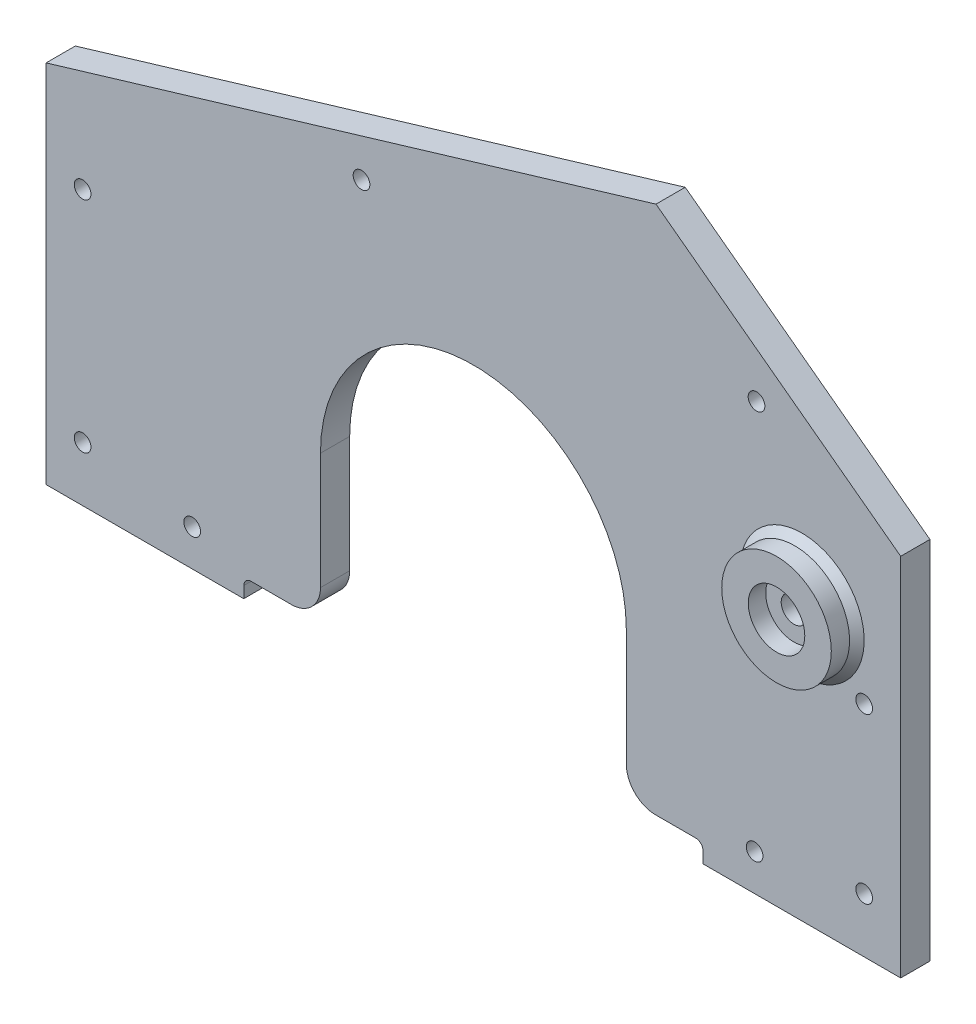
SolidWorks part; units mm, degrees
ref_plane "Front Plane" through (0, 0, 0) normal (0, 0, 1) x (1, 0, 0)
ref_plane "Top Plane" through (0, 0, 0) normal (0, 1, 0) x (1, 0, 0)
ref_plane "Right Plane" through (0, 0, 0) normal (1, 0, 0) x (0, 0, -1)
sketch "Sketch1" plane through (0, 0, 0) normal (0, 0, 1) x (1, 0, 0)
  line L0 (-135.2066, -69.6735) -> (-135.2066, 30.3265)
  line L1 (-135.2066, 30.3265) -> (31.7934, 80.3265)
  line L2 (31.7934, 80.3265) -> (98.7934, 30.3265)
  line L3 (98.7934, 30.3265) -> (98.7934, -69.6735)
  line L4 (98.7934, -69.6735) -> (-135.2066, -69.6735)
  line L5 (31.7934, 80.3265) -> (31.7934, -69.6735) construction
  line L6 (-135.2066, -59.6735) -> (98.7934, -59.6735) construction
  line L7 (-125.2066, 33.3205) -> (-125.2066, -69.6735) construction
  line L8 (-135.2066, 19.8879) -> (41.7761, 72.8768) construction
  line L9 (19.8607, 76.7539) -> (98.7934, 17.8489) construction
  line L10 (88.7934, 37.7892) -> (88.7934, -69.6735) construction
  line L11 (-18.2066, -69.6735) -> (-18.2066, 65.3565) construction
  line L12 (-135.2066, -24.6735) -> (98.7934, -24.6735) construction
  line L13 (-135.2066, 5.3265) -> (98.7934, 5.3265) construction
  line L14 (71.7934, 50.4758) -> (71.7934, -69.6735) construction
  line L15 (65.2934, 55.3265) -> (42.5646, 24.8699) construction
  line L16 (-51.7066, 55.3265) -> (-39.6605, 15.0927) construction
  line L17 (-95.2066, -69.6735) -> (-95.2066, -51.1874) construction
  line L18 (-135.2066, 5.3265) -> (-112.0673, 5.3265) construction
  line L19 (98.7934, -9.6735) -> (76.9523, -9.6735) construction
  circle A0 centre (-125.2066, 5.3265) radius 2.285
  circle A2 centre (-95.2066, -59.6735) radius 2.285
  circle A7 centre (59.3125, 47.3122) radius 2.285
  circle A8 centre (71.7934, 5.3265) radius 7.7375 construction
  circle A9 centre (-48.8384, 45.7467) radius 2.285
  circle A10 centre (58.7934, -59.6735) radius 2.285
  circle A11 centre (-125.2066, -54.6735) radius 2.285
  circle A12 centre (88.7934, -54.6735) radius 2.285
  circle A14 centre (88.7934, -9.6735) radius 2.285
  point P28 (-48.8384, 45.7467)
  point P30 (59.3125, 47.3122)
  point P31 (71.7934, 5.3265)
  point P51 (88.7934, -9.6735)
  dimension "D11" = 4.57
  dimension "D12" = 15
  dimension "D13" = 4.57
  dimension "D14" = 25
  dimension "D15" = 4.57
  dimension "D16" = 4.57
  dimension "D18" = 4.57
  dimension "D22" = 15.475
  dimension "D1" = 234
  dimension "D2" = 100
  dimension "D3" = 100
  dimension "D4" = 50
  dimension "D5" = 67
  dimension "D6" = 10
  dimension "D7" = 10
  dimension "D8" = 10
  dimension "D9" = 10
  dimension "D10" = 10
  dimension "D19" = 45
  dimension "D20" = 30
  dimension "D21" = 90
  dimension "D23" = 40
extrude "Boss-Extrude1" add sketch "Sketch1" along normal blind 8
sketch "Sketch2" plane through (0, 0, 0) normal (0, 0, 1) x (1, 0, 0)
  line L0 (-135.2066, 5.3265) -> (98.7934, 5.3265) construction
  line L1 (71.7934, 50.4758) -> (71.7934, -69.6735) construction
  line L2 (-135.2066, 5.3265) -> (98.7934, 5.3265) construction
  line L3 (71.7934, 50.4758) -> (71.7934, -69.6735) construction
  circle A0 centre (71.7934, 5.3265) radius 7.7375 construction
  circle A1 centre (71.7934, 5.3265) radius 7.7375 construction
  circle A2 centre (71.7934, 5.3265) radius 15
  dimension "D1" = 30
extrude "Boss-Extrude2" add sketch "Sketch2" along normal blind 15
sketch "Sketch3" plane through (0, 0, 0) normal (0, 0, 1) x (1, 0, 0)
  line L0 (98.7934, -69.6735) -> (-135.2066, -69.6735) construction
  line L1 (-135.2066, -24.6735) -> (98.7934, -24.6735) construction
  line L2 (-18.2066, -69.6735) -> (-18.2066, 65.3565) construction
  line L3 (98.7934, -69.6735) -> (-135.2066, -69.6735) construction
  line L4 (-135.2066, -24.6735) -> (98.7934, -24.6735) construction
  line L5 (-18.2066, -69.6735) -> (-18.2066, 65.3565) construction
  line L6 (23.6684, -24.6735) -> (23.6684, -69.6735) construction
  line L7 (-60.0816, -24.6735) -> (-60.0816, -69.6735) construction
  line L8 (-81.0816, -66.5485) -> (44.6684, -66.5485) construction
  line L9 (-81.0816, -69.6735) -> (-81.0816, -66.5485) construction
  line L10 (44.6684, -69.6735) -> (44.6684, -66.5485) construction
  line L11 (-81.0816, -64.5435) -> (44.6684, -64.5435) construction
  line L13 (44.6684, -69.6735) -> (44.6684, -64.5435)
  line L14 (44.6684, -64.5435) -> (23.6684, -64.5435)
  line L15 (23.6684, -64.5435) -> (23.6684, -24.6735)
  line L16 (-81.0816, -69.6735) -> (-81.0816, -64.5435)
  line L17 (-81.0816, -64.5435) -> (-60.0816, -64.5435)
  line L18 (-60.0816, -64.5435) -> (-60.0816, -24.6735)
  line L19 (-81.0816, -69.6735) -> (-81.0816, -72.3335)
  line L20 (-81.0816, -72.3335) -> (44.6684, -72.3335)
  line L21 (44.6684, -72.3335) -> (44.6684, -69.6735)
  line L22 (-135.2066, 5.3265) -> (98.7934, 5.3265) construction
  line L23 (71.7934, 50.4758) -> (71.7934, -69.6735) construction
  line L24 (-135.2066, 5.3265) -> (98.7934, 5.3265) construction
  line L25 (71.7934, 50.4758) -> (71.7934, -69.6735) construction
  circle A0 centre (-18.2066, -24.6735) radius 41.875 construction
  arc A1 (-60.0816, -24.6735) -> (23.6684, -24.6735) centre (-18.2066, -24.6735) cw
  circle A2 centre (71.7934, 5.3265) radius 3.5
  point P16 (-18.2066, -66.5485)
  dimension "D1" = 83.75
  dimension "D5" = 7
  dimension "D2" = 62.875
  dimension "D3" = 5.13
  dimension "D4" = 2.66
extrude "Cut-Extrude1" cut sketch "Sketch3" along normal blind 18 and the other way blind 2
sketch "Sketch4" plane through (0, 0, 0) normal (0, 0, 1) x (1, 0, 0)
  line L0 (-135.2066, 5.3265) -> (98.7934, 5.3265) construction
  line L1 (71.7934, 50.4758) -> (71.7934, -69.6735) construction
  line L2 (-135.2066, 5.3265) -> (98.7934, 5.3265) construction
  line L3 (71.7934, 50.4758) -> (71.7934, -69.6735) construction
  circle A0 centre (71.7934, 5.3265) radius 7.7375 construction
  circle A1 centre (71.7934, 5.3265) radius 7.7375
extrude "Cut-Extrude2" cut sketch "Sketch4" along normal blind 6 from offset 10.222
fillet "Fillet1" radius 8 2 edges at (-60.0816, -64.5435, 4) (23.6684, -64.5435, 4)
fillet "Fillet2" radius 2 2 edges at (-81.0816, -64.5435, 4) (44.6684, -64.5435, 4)
chamfer "Chamfer1" distance 2 angle 45 1 edges at (56.7934, 5.3265, 8)
